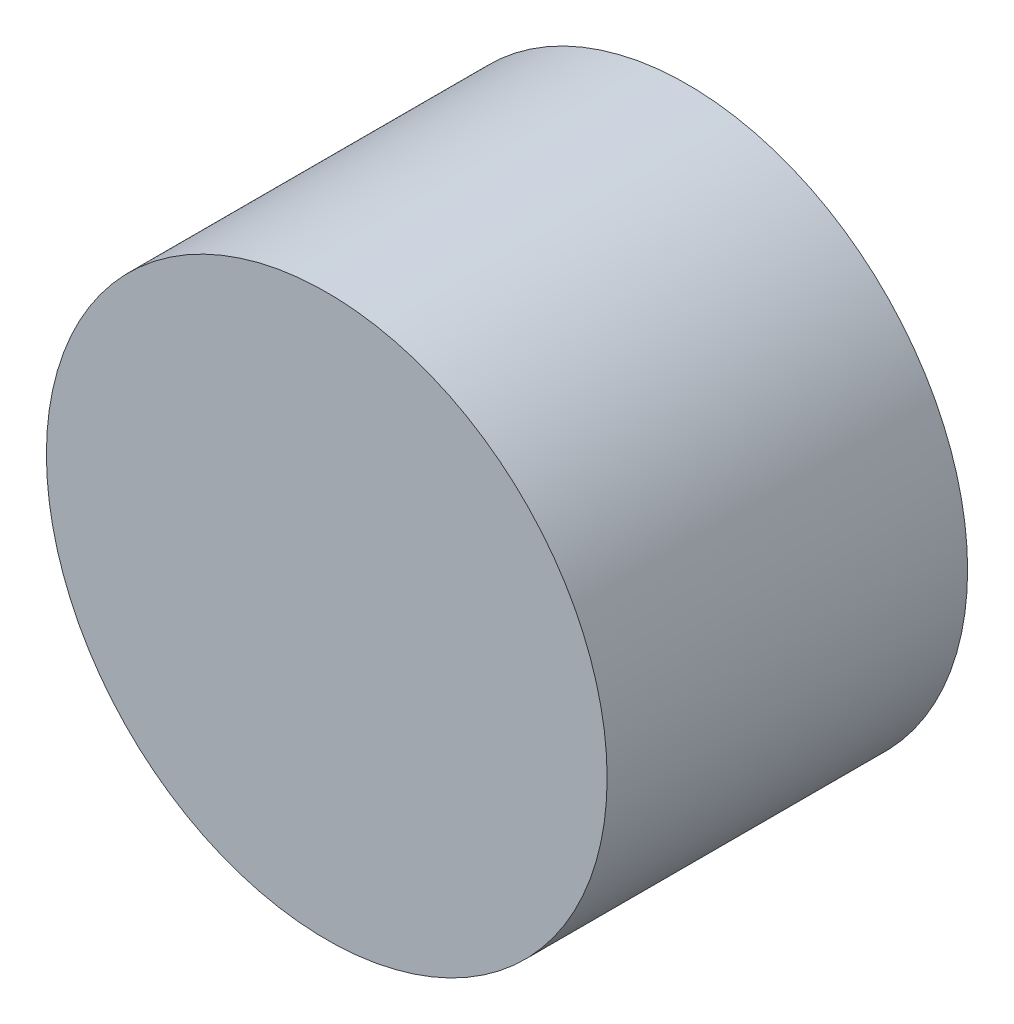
SolidWorks part; units mm, degrees
ref_plane "Plan de face" through (0, 0, 0) normal (0, 0, 1) x (1, 0, 0)
ref_plane "Plan de dessus" through (0, 0, 0) normal (0, 1, 0) x (1, 0, 0)
ref_plane "Plan de droite" through (0, 0, 0) normal (1, 0, 0) x (0, 0, -1)
sketch "Esquisse1" plane through (0, 0, 0) normal (0, 0, 1) x (1, 0, 0)
  circle A0 centre (0, 0) radius 7
  dimension "D1" = 14
extrude "Extrusion1" add sketch "Esquisse1" along normal blind 9
